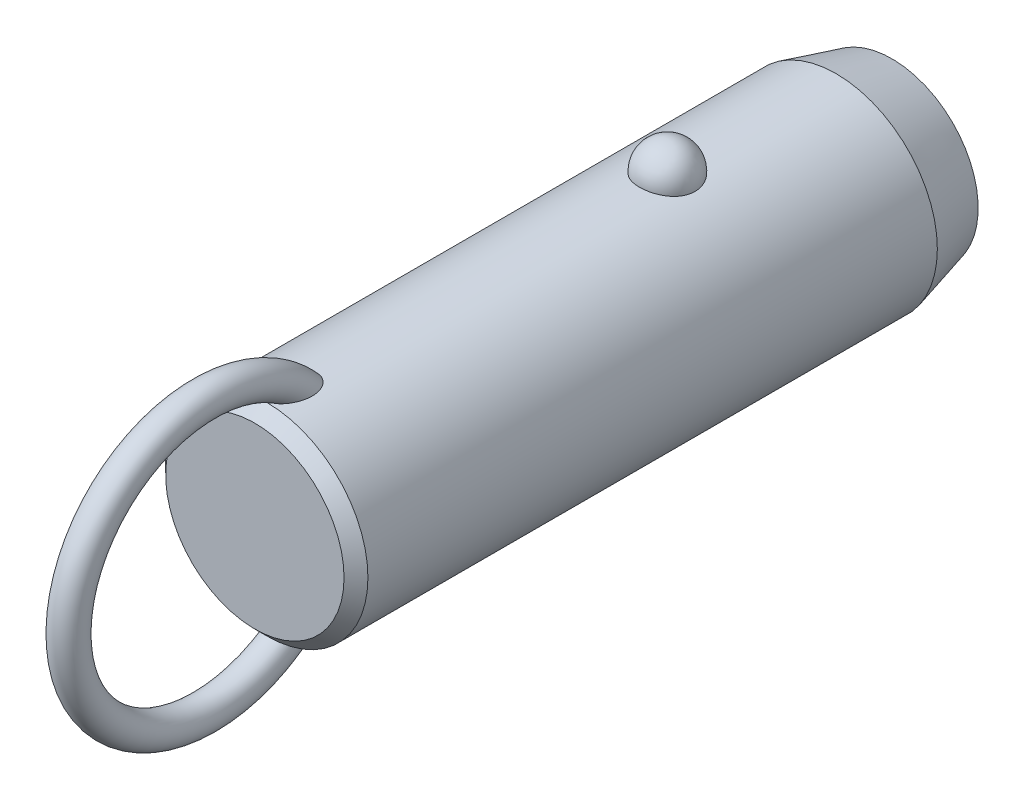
SolidWorks part; units mm, degrees
ref_plane "Front Plane" through (0, 0, 0) normal (0, 0, 1) x (1, 0, 0)
ref_plane "Top Plane" through (0, 0, 0) normal (0, 1, 0) x (1, 0, 0)
ref_plane "Right Plane" through (0, 0, 0) normal (1, 0, 0) x (0, 0, -1)
sketch "Sketch2" plane through (0, 0, 0) normal (0, 0, 1) x (1, 0, 0)
  circle A0 centre (0, 0) radius 12.7
  point P3 (0, 12.7)
  dimension "D1" = 25.4
extrude "Boss-Extrude1" add sketch "Sketch2" along normal blind 35.6
sketch "Sketch3" plane through (0, 0, 0) normal (0, 0, -1) x (-1, 0, 0)
  circle A0 centre (0, 0) radius 12.7
  dimension "D1" = 25.4
extrude "Boss-Extrude2" add sketch "Sketch3" along normal blind 31.7
chamfer "Chamfer1" distance 7 angle 15 1 edges at (-12.7, 0, -31.7)
sketch "Sketch12" plane through (0, 0, 0) normal (1, 0, 0) x (0, 0, -1)
  line L0 (-35.6, 12.7) -> (-35.6, -12.7) construction
  point P0 (-35.6, 0)
sketch "Sketch13" plane through (0, 0, 0) normal (1, 0, 0) x (0, 0, -1)
  circle A0 centre (-54.65, 0) radius 19.05
  point P2 (-35.6, 0)
  dimension "D1" = 38.1
sketch "Sketch14" plane through (0, 0, 0) normal (0, 1, 0) x (1, 0, 0)
  circle A0 centre (0, -37.6) radius 2
  point P2 (0, -35.6)
  dimension "D1" = 4
sweep "Sweep1" add profiles "Sketch14" path "Sketch13"
sketch "Sketch15" plane through (0, 0, 35.6) normal (0, 0, 1) x (1, 0, 0)
  circle A0 centre (0, 0) radius 12.7
  dimension "D1" = 25.4
extrude "Boss-Extrude3" add sketch "Sketch15" along normal blind 12.7
chamfer "Chamfer2" distance 1.5 angle 45 1 edges at (12.7, 0, 48.3)
sketch "Sketch18" plane through (0, 0, 0) normal (1, 0, 0) x (0, 0, -1)
  line L0 (24.7, 12.7) -> (-40.451, 12.7) construction
  line L1 (3.5, 16.2) -> (3.5, 9.2)
  line L2 (-40.451, -12.7) -> (24.7, -12.7) construction
  arc A0 (3.5, 16.2) -> (3.5, 9.2) centre (3.5, 12.7) ccw
  point P4 (0, 12.7)
  dimension "D1" = 28.9
revolve "Revolve1" add sketch "Sketch18" angle 360 about L1
